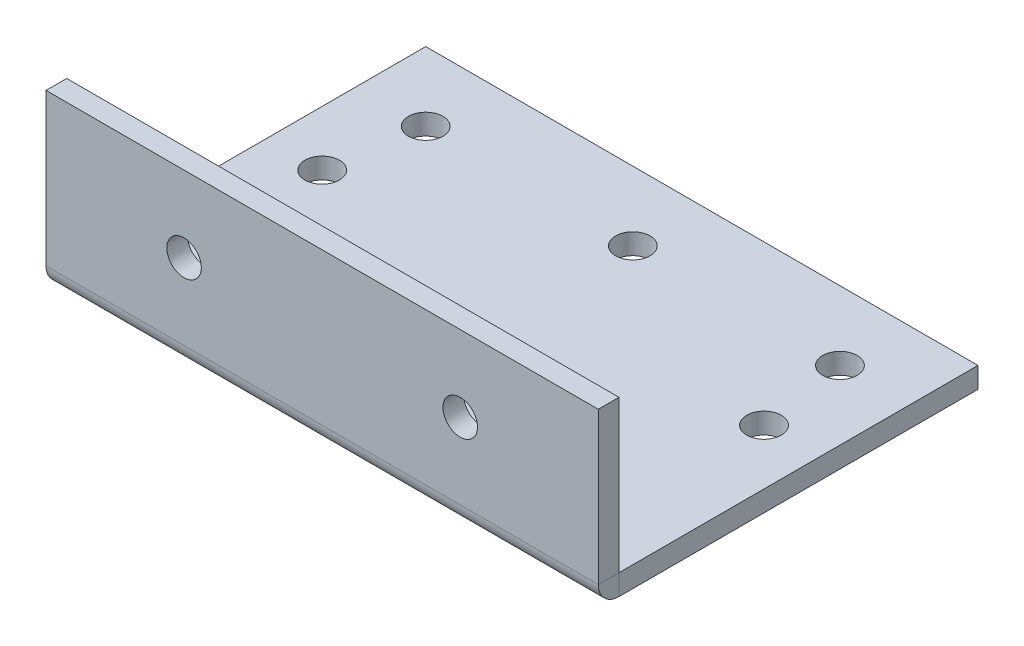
SolidWorks part; units mm, degrees
ref_plane "Front" through (0, 0, 0) normal (0, 0, 1) x (1, 0, 0)
ref_plane "Top" through (0, 0, 0) normal (0, 1, 0) x (1, 0, 0)
ref_plane "Right" through (0, 0, 0) normal (1, 0, 0) x (0, 0, -1)
sketch "Sketch1" plane through (0, 0, 0) normal (0, 1, 0) x (1, 0, 0)
  line L1 (0, 0) -> (80, 0)
  line L2 (0, 0) -> (0, 80)
  line L3 (0, 80) -> (80, 80)
  line L4 (80, 0) -> (80, 80)
  circle A0 centre (10, 70) radius 2.5
  circle A1 centre (40, 70) radius 2.5
  circle A2 centre (70, 70) radius 2.5
  circle A3 centre (8, 57) radius 2.5
  circle A4 centre (72, 57) radius 2.5
  circle A5 centre (20, 11) radius 2.5
  circle A6 centre (60, 11) radius 2.5
sheet metal parameters "Sheet-Metal1" thickness 3 parameters "D1"=0
base flange "Base-Flange1" sketch "Sketch1" thickness 3 reverse thickness direction yes parameters "D1"=0
sketch "Sketch3" plane through (0, 3, 0) normal (0, 1, 0) x (-1, 0, 0)
  line L1 (0, -25) -> (-80, -25)
sketched bend "Sketched Bend2" parameters "D1"=0
bend "SketchBend2" bend radius 0 bend angle 90 parameters "D5"=1
flat pattern "Flat-Pattern1"
sketch "Bend-Lines1" plane through (0, 0, 0) normal (0, 1, 0) x (-1, 0, 0)
bend of the flat pattern "Flatten-<SketchBend2>1"
